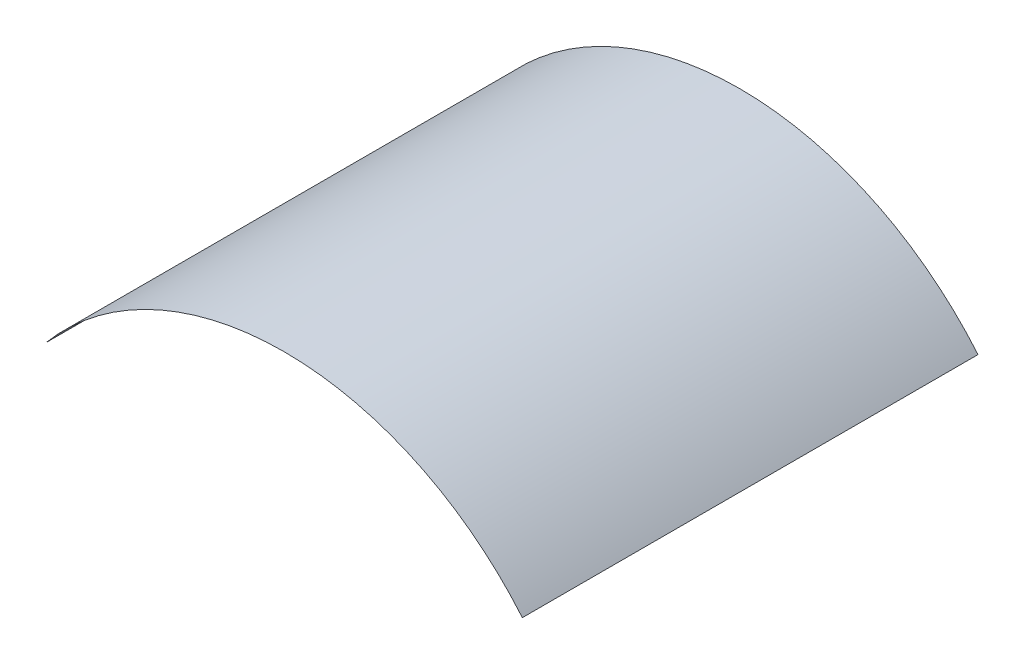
SolidWorks part; units mm, degrees
ref_plane "Front Plane" through (0, 0, 0) normal (0, 0, 1) x (1, 0, 0)
ref_plane "Top Plane" through (0, 0, 0) normal (0, 1, 0) x (1, 0, 0)
ref_plane "Right Plane" through (0, 0, 0) normal (1, 0, 0) x (0, 0, -1)
sketch "Sketch1" plane through (0, 0, 0) normal (0, 0, 1) x (1, 0, 0)
  line L0 (0, 0) -> (0, 26.8466) construction
  arc A0 (-57.5, 0) -> (57.5, 0) centre (0, -48.1534) cw
  dimension "D1" = 75
  dimension "D2" = 115
surface "Surface-Extrude1" sketch "Sketch1" parameters "D1"=110
sketch3d "3DSketch1"
  line L0 (42.577, 13.5896, -35) -> (42.577, 13.5896, 35)
  line L1 (-42.577, 13.5896, -35) -> (-42.577, 13.5896, 35)
  line L2 (42.577, 13.5896, -35) -> (42.577, 13.5896, 35)
  line L3 (-42.577, 13.5896, -35) -> (-42.577, 13.5896, 35)
  arc A0 (-42.577, 13.5896, 35) -> (42.577, 13.5896, 35) centre (0, -48.1534, 35) ccw
  arc A1 (-42.577, 13.5896, -35) -> (42.577, 13.5896, -35) centre (0, -48.1534, -35) ccw
  arc A2 (-42.577, 13.5896, 35) -> (42.577, 13.5896, 35) centre (0, -48.1534, 35) ccw
  arc A3 (-42.577, 13.5896, -35) -> (42.577, 13.5896, -35) centre (0, -48.1534, -35) ccw
  point P4 (0, -48.1534, -40)
  point P7 (0, -48.1534, -110)
  point P8 (0, -48.1534, -40)
  point P9 (0, -48.1534, -110)
  dimension "D1" = 20
